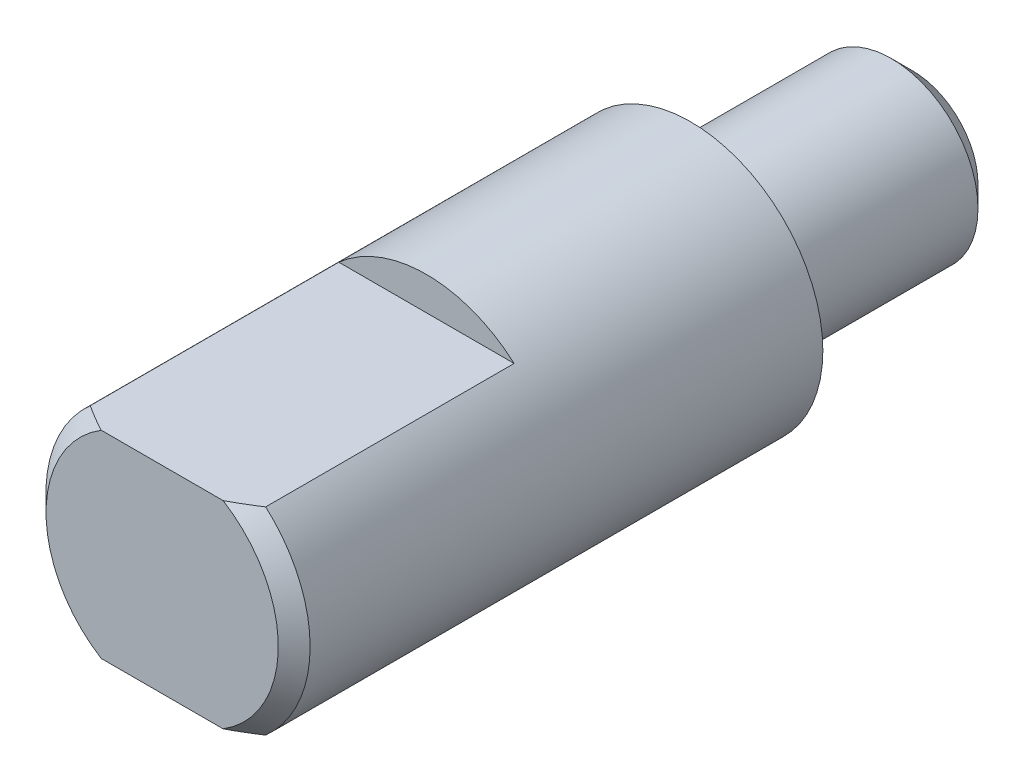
SolidWorks part; units mm, degrees
ref_plane "Front" through (0, 0, 0) normal (0, 0, 1) x (1, 0, 0)
ref_plane "Top" through (0, 0, 0) normal (0, 1, 0) x (1, 0, 0)
ref_plane "Right" through (0, 0, 0) normal (1, 0, 0) x (0, 0, -1)
sketch "Sketch1" plane through (0, 0, 0) normal (1, 0, 0) x (0, 0, -1)
  line L0 (13.966, 1.5728) -> (13.456, 2.0828)
  line L1 (-4.064, 0) -> (13.966, 0)
  line L2 (-4.064, 0) -> (-4.064, 2.79)
  line L3 (-3.684, 3.175) -> (8.636, 3.175)
  line L4 (8.636, 2.0828) -> (8.636, 3.175)
  line L5 (152.5672, 0) -> (50152.5672, 0) construction
  line L6 (-4.064, 2.79) -> (-3.684, 3.175)
  line L7 (8.636, 2.0828) -> (13.456, 2.0828)
  line L8 (13.966, 0) -> (13.966, 1.5728)
  point P2 (0, 0)
  dimension "D1" = 12.7
  dimension "D2" = 5.33
  dimension "D3" = 6.35
  dimension "D4" = 4.1656
  dimension "D5" = 45
  dimension "D6" = 0.51
  dimension "D7" = 2.79
  dimension "D8" = 0.38
  dimension "D9" = 4.064
revolve "Revolve1" add sketch "Sketch1" angle 360 about L1
sketch "Sketch2" plane through (0, 0, 0) normal (1, 0, 0) x (0, 0, -1)
  line L0 (-4.064, 2.79) -> (-4.064, -2.79) construction
  line L1 (-4.064, 2.375) -> (2.286, 2.375)
  line L2 (-4.064, 2.375) -> (-4.064, 3.175)
  line L3 (-4.064, 3.175) -> (2.286, 3.175)
  line L4 (2.286, 2.375) -> (2.286, 3.175)
  line L5 (8.636, 3.175) -> (-3.684, 3.175) construction
  line L6 (-4.064, 0) -> (6.0404, 0) construction
  line L7 (2.286, -2.375) -> (2.286, -3.175)
  line L8 (-4.064, -3.175) -> (2.286, -3.175)
  line L9 (-4.064, -2.375) -> (-4.064, -3.175)
  line L10 (-4.064, -2.375) -> (2.286, -2.375)
  dimension "D1" = 0.8
  dimension "D2" = 6.35
extrude "Cut-Extrude1" cut sketch "Sketch2" against normal mid plane 10
